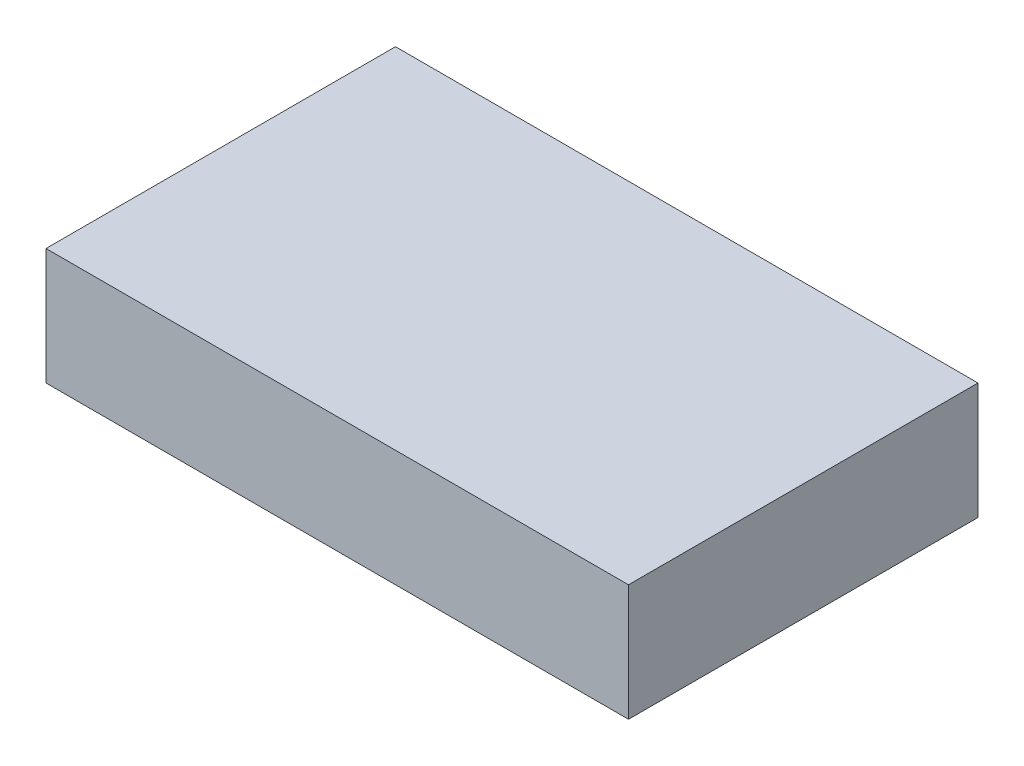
SolidWorks part; units mm, degrees
ref_plane "正面" through (0, 0, 0) normal (0, 0, 1) x (1, 0, 0)
ref_plane "平面" through (0, 0, 0) normal (0, 1, 0) x (1, 0, 0)
ref_plane "右側面" through (0, 0, 0) normal (1, 0, 0) x (0, 0, -1)
sketch "ｽｹｯﾁ1" plane through (0, 0, 0) normal (0, 1, 0) x (1, 0, 0)
  line L1 (-25, -15) -> (25, -15)
  line L2 (-25, -15) -> (-25, 15)
  line L3 (-25, 15) -> (25, 15)
  line L4 (25, -15) -> (25, 15)
  line L5 (-25, -15) -> (25, 15) construction
  line L6 (-25, 15) -> (25, -15) construction
  point P0 (0, 0)
  dimension "D1" = 50
  dimension "D2" = 30
extrude "ﾎﾞｽ - 押し出し1" add sketch "ｽｹｯﾁ1" along normal blind 10
